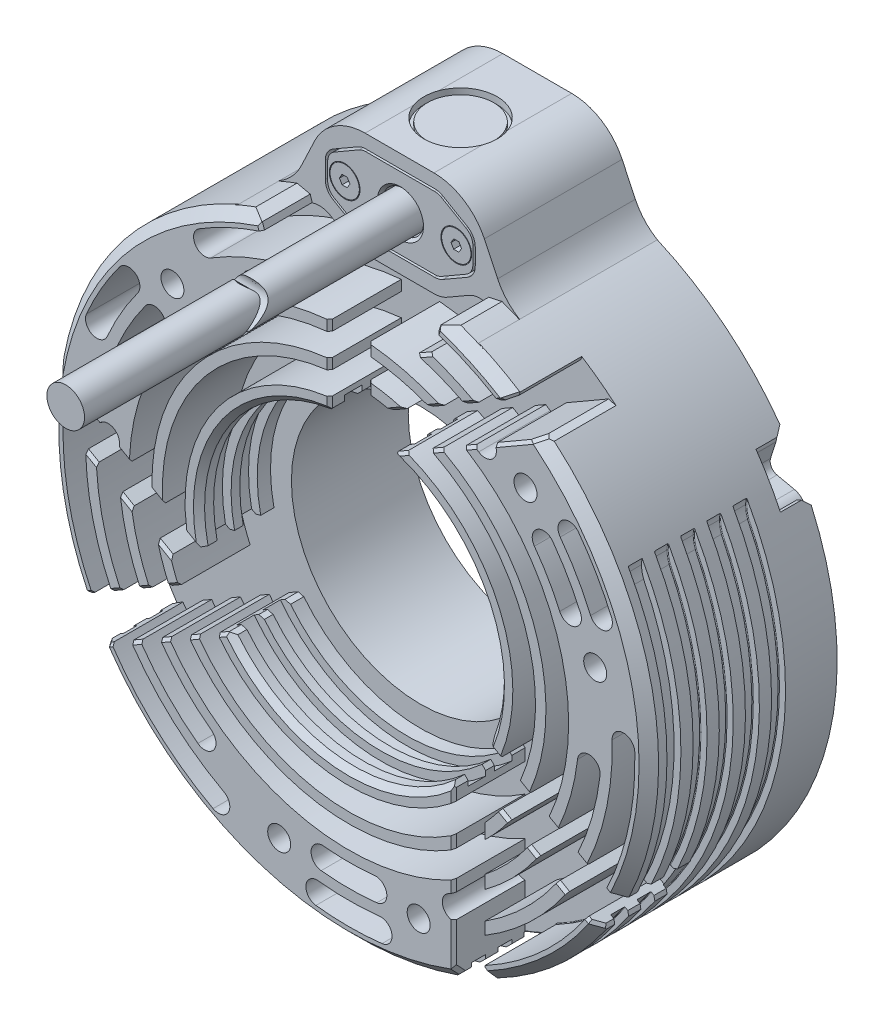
SolidWorks part; units mm, degrees
ref_plane "Front Plane" through (0, 0, 0) normal (0, 0, 1) x (1, 0, 0)
ref_plane "Top Plane" through (0, 0, 0) normal (0, 1, 0) x (1, 0, 0)
ref_plane "Right Plane" through (0, 0, 0) normal (1, 0, 0) x (0, 0, -1)
imported_body "Imported1"
sketch "Sketch1" plane through (0, 0, 17.75) normal (0, 0, 1) x (1, 0, 0)
  circle A0 centre (0.1386, 44.0324) radius 2.7
  circle A1 centre (0.1386, 44.0324) radius 2.9 construction
  dimension "D1" = 5.4
extrude "Boss-Extrude1" add sketch "Sketch1" along normal blind 50
sketch "Sketch2" plane through (0, 0, 0) normal (1, 0, 0) x (0, 0, -1)
  line L0 (-42.75, 44.0324) -> (-67.75, 44.0324) construction
  line L1 (-67.75, 46.7324) -> (-67.75, 41.3324) construction
  line L2 (-42.75, 47.2824) -> (-42.75, 40.7824) construction
  arc A0 (-42.9713, 46.834) -> (-42.5287, 47.7307) centre (-42.75, 47.2824) cw
  arc A1 (-43.0006, 40.3497) -> (-42.4994, 41.215) centre (-42.75, 40.7824) ccw
  spline S0 degree 3 poles (-42.75, 47.2824) (-40.5568, 46.1999) (-42.7997, 44.0841) (-44.6993, 41.9112) (-42.75, 40.7824) knots 0 0 0 0 0.508728 1 1 1 1 construction
  spline S1 degree 1 poles (-42.9713, 46.834) (-43.0006, 40.3497) knots 0 0 1 1 construction
  spline S2 degree 3 poles (-42.9713, 46.834) (-42.8589, 46.7785) (-42.6226, 46.6504) (-42.2949, 46.4276) (-42.0591, 46.1781) (-41.9925, 45.9938) (-41.9947, 45.8212) (-42.1033, 45.5462) (-42.4186, 45.0936) (-43.0475, 44.4461) (-43.8489, 43.6086) (-44.3536, 42.801) (-44.4186, 41.98) (-44.1927, 41.3608) (-43.8029, 40.9145) (-43.3886, 40.5885) (-43.1287, 40.4239) (-43.0006, 40.3497) knots 0 0 0 0 0.03125 0.0625 0.125 0.1875 0.25 0.3125 0.375 0.5 0.625 0.75 0.8125 0.875 0.9375 0.96875 1 1 1 1
  spline S3 degree 1 poles (-42.5287, 47.7307) (-42.4994, 41.215) knots 0 0 1 1 construction
  spline S4 degree 3 poles (-42.5287, 47.7307) (-42.3913, 47.6629) (-42.1105, 47.511) (-41.6636, 47.2093) (-41.2367, 46.7915) (-40.9701, 46.1803) (-41.0073, 45.5558) (-41.238, 45.0332) (-41.6722, 44.4207) (-42.3491, 43.7326) (-42.9618, 43.0865) (-43.2725, 42.6253) (-43.3869, 42.3341) (-43.396, 42.1225) (-43.3274, 41.9075) (-43.1135, 41.6462) (-42.8165, 41.4105) (-42.6022, 41.2745) (-42.4994, 41.215) knots 0 0 0 0 0.03125 0.0625 0.125 0.1875 0.25 0.3125 0.375 0.5 0.625 0.6875 0.75 0.8125 0.875 0.9375 0.96875 1 1 1 1
  point P2 (-42.75, 44.0324)
  dimension "D1" = 6.5
  dimension "D2" = 25
  dimension "D3" = 0.5
  dimension "D4" = 0.5
extrude "Cut-Extrude1" cut sketch "Sketch2" against normal through all both and the other way through all
sketch "Sketch3" [suppressed] plane through (0, 0, 0) normal (0, 0, -1) x (-1, 0, 0)
  line L18 (-34.2168, 22.8056) -> (-33.4491, 20.3767)
  line L19 (-34.3713, 18.7794) -> (-36.8586, 18.2299)
  line L20 (-2.6418, -41.0354) -> (-0.9222, -39.1562)
  line L21 (0.9222, -39.1562) -> (2.6418, -41.0354)
  line L22 (36.8586, 18.2299) -> (34.3713, 18.7794)
  line L23 (33.4491, 20.3767) -> (34.2168, 22.8056)
  line L24 (13.2394, 42.4277) -> (11.2805, 46.5215)
  line L25 (4.9662, 50.5) -> (-4.9662, 50.5)
  line L26 (-11.2805, 46.5215) -> (-13.2394, 42.4277)
  line L27 (-34.2168, 22.8056) -> (-33.4491, 20.3767)
  line L28 (-34.3713, 18.7794) -> (-36.8586, 18.2299)
  line L29 (-2.6418, -41.0354) -> (-0.9222, -39.1562)
  line L30 (0.9222, -39.1562) -> (2.6418, -41.0354)
  line L31 (36.8586, 18.2299) -> (34.3713, 18.7794)
  line L32 (33.4491, 20.3767) -> (34.2168, 22.8056)
  line L33 (13.2394, 42.4277) -> (11.2805, 46.5215)
  line L34 (4.9662, 50.5) -> (-4.9662, 50.5)
  line L35 (-11.2805, 46.5215) -> (-13.2394, 42.4277)
  circle A19 centre (0, 0) radius 20
  circle A20 centre (0, 0) radius 20
  arc A34 (-33.8868, 24.8129) -> (-34.2168, 22.8056) centre (-32.0715, 23.4837) ccw
  arc A35 (-34.3713, 18.7794) -> (-33.4491, 20.3767) centre (-34.641, 20) ccw
  arc A36 (-36.8586, 18.2299) -> (-38.4321, 16.9404) centre (-36.3732, 16.0329) ccw
  arc A37 (-38.4321, 16.9404) -> (-4.5452, -41.7533) centre (0, 0) ccw
  arc A38 (-4.5452, -41.7533) -> (-2.6418, -41.0354) centre (-4.3017, -39.5165) ccw
  arc A39 (0.9222, -39.1562) -> (-0.9222, -39.1562) centre (0, -40) ccw
  arc A40 (2.6418, -41.0354) -> (4.5452, -41.7533) centre (4.3017, -39.5165) ccw
  arc A41 (4.5452, -41.7533) -> (38.4321, 16.9404) centre (0, 0) ccw
  arc A42 (38.4321, 16.9404) -> (36.8586, 18.2299) centre (36.3732, 16.0329) ccw
  arc A43 (33.4491, 20.3767) -> (34.3713, 18.7794) centre (34.641, 20) ccw
  arc A44 (34.2168, 22.8056) -> (33.8868, 24.8129) centre (32.0715, 23.4837) ccw
  arc A45 (33.8868, 24.8129) -> (17.5888, 38.1397) centre (0, 0) ccw
  arc A46 (13.2394, 42.4277) -> (17.5888, 38.1397) centre (21.3578, 46.3125) ccw
  arc A47 (11.2805, 46.5215) -> (4.9662, 50.5) centre (4.9662, 43.5) ccw
  arc A48 (-4.9662, 50.5) -> (-11.2805, 46.5215) centre (-4.9662, 43.5) ccw
  arc A49 (-17.5888, 38.1397) -> (-13.2394, 42.4277) centre (-21.3578, 46.3125) ccw
  arc A50 (-17.5888, 38.1397) -> (-33.8868, 24.8129) centre (0, 0) ccw
  arc A51 (-33.8868, 24.8129) -> (-34.2168, 22.8056) centre (-32.0715, 23.4837) ccw
  arc A52 (-34.3713, 18.7794) -> (-33.4491, 20.3767) centre (-34.641, 20) ccw
  arc A53 (-36.8586, 18.2299) -> (-38.4321, 16.9404) centre (-36.3732, 16.0329) ccw
  arc A54 (-38.4321, 16.9404) -> (-4.5452, -41.7533) centre (0, 0) ccw
  arc A55 (-4.5452, -41.7533) -> (-2.6418, -41.0354) centre (-4.3017, -39.5165) ccw
  arc A56 (0.9222, -39.1562) -> (-0.9222, -39.1562) centre (0, -40) ccw
  arc A57 (2.6418, -41.0354) -> (4.5452, -41.7533) centre (4.3017, -39.5165) ccw
  arc A58 (4.5452, -41.7533) -> (38.4321, 16.9404) centre (0, 0) ccw
  arc A59 (38.4321, 16.9404) -> (36.8586, 18.2299) centre (36.3732, 16.0329) ccw
  arc A60 (33.4491, 20.3767) -> (34.3713, 18.7794) centre (34.641, 20) ccw
  arc A61 (34.2168, 22.8056) -> (33.8868, 24.8129) centre (32.0715, 23.4837) ccw
  arc A62 (33.8868, 24.8129) -> (17.5888, 38.1397) centre (0, 0) ccw
  arc A63 (13.2394, 42.4277) -> (17.5888, 38.1397) centre (21.3578, 46.3125) ccw
  arc A64 (11.2805, 46.5215) -> (4.9662, 50.5) centre (4.9662, 43.5) ccw
  arc A65 (-4.9662, 50.5) -> (-11.2805, 46.5215) centre (-4.9662, 43.5) ccw
  arc A66 (-17.5888, 38.1397) -> (-13.2394, 42.4277) centre (-21.3578, 46.3125) ccw
  arc A67 (-17.5888, 38.1397) -> (-33.8868, 24.8129) centre (0, 0) ccw
  dimension "D1" = 0
  dimension "D2" = 0
extrude "Cut-Extrude2" [suppressed] cut sketch "Sketch3" against normal up to surface and the other way through all
sketch "Sketch4" [suppressed] plane through (0, 0, 1) normal (0, 0, -1) x (-1, 0, 0)
  circle A0 centre (0, 0) radius 42
  arc A1 (4.5452, -41.7533) -> (38.4321, 16.9404) centre (0, 0) ccw construction
extrude "Boss-Extrude2" [suppressed] add sketch "Sketch4" against normal up to surface (3 mm away) contours A0 M10 M14 M13 M12 M11 | A0 M16 M20 M19 M18 M17 | A0 M4 M8 M7 M6 M5
